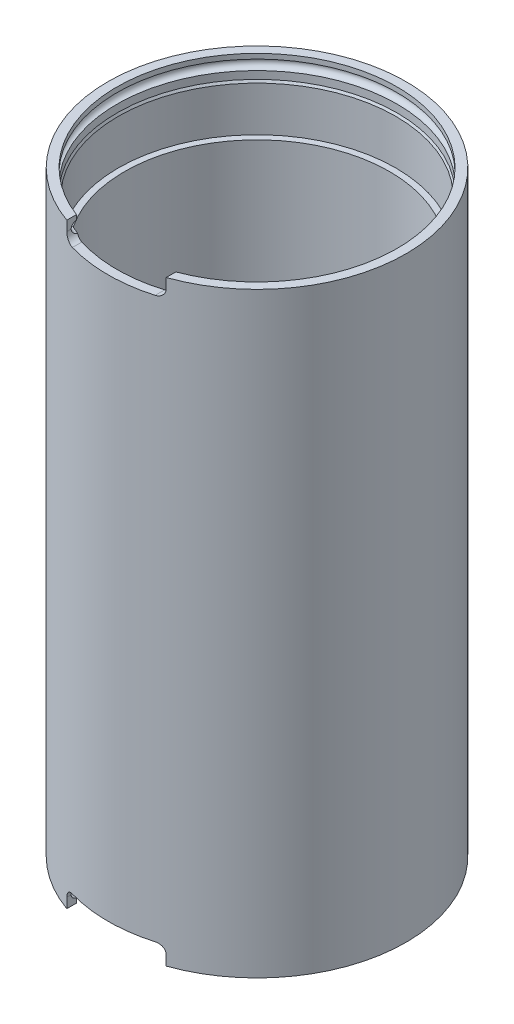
SolidWorks part; units mm, degrees
ref_plane "Front Plane" through (0, 0, 0) normal (0, 0, 1) x (1, 0, 0)
ref_plane "Top Plane" through (0, 0, 0) normal (0, 1, 0) x (1, 0, 0)
ref_plane "Right Plane" through (0, 0, 0) normal (1, 0, 0) x (0, 0, -1)
sketch "Sketch1" plane through (0, 0, 0) normal (0, 1, 0) x (1, 0, 0)
  circle A0 centre (0, 0) radius 57.15
  circle A1 centre (0, 0) radius 50.8
  dimension "D1" = 114.3
  dimension "D2" = 101.6
extrude "Boss-Extrude1" add sketch "Sketch1" along normal mid plane 228.6
sketch "Sketch3" plane through (0, 0, 0) normal (0, 0, 1) x (1, 0, 0)
  line L0 (0, -114.3) -> (0, 146.2879) construction
  line L1 (-50.8, -114.3) -> (50.8, -114.3) construction
  line L2 (-50.8, 114.3) -> (-53.6829, 114.3)
  line L3 (57.15, 114.3) -> (-57.15, 114.3) construction
  line L5 (-53.6829, 114.3) -> (-53.6829, 112.395)
  line L6 (-53.6829, 105.6549) -> (-53.1749, 104.775)
  line L7 (-53.1749, 104.775) -> (-53.1749, 87.63)
  line L8 (-53.1749, 87.63) -> (-50.8, 87.63)
  line L9 (-50.8, 87.63) -> (-50.8, 114.3)
  line L10 (-53.6829, 108.585) -> (-53.6829, 105.6549)
  arc A0 (-53.6829, 112.395) -> (-53.6829, 108.585) centre (-53.6829, 110.49) ccw
other "AlignGroup1" parameters "D4"=7.4171, "D1"=85.1374, "D2"=90, "D3"=101.6, "D5"=9.525, "D6"=26.67, "D7"=146.2879, "D8"=111.3446, "D9"=11.114
revolve "Cut-Revolve1" cut sketch "Sketch3" angle 360 about L0
sketch "Sketch4" plane through (0, 0, 0) normal (0, 0, 1) x (1, 0, 0)
  line L0 (53.6829, 114.3) -> (-53.6829, 114.3) construction
  line L1 (-19.05, 114.3) -> (19.05, 114.3)
  line L2 (-19.05, 114.3) -> (-19.05, 110.49)
  line L3 (-15.875, 107.315) -> (15.875, 107.315)
  line L4 (19.05, 114.3) -> (19.05, 110.49)
  line L10 (0, 0) -> (0, 107.315) construction
  arc A2 (15.875, 107.315) -> (19.05, 110.49) centre (15.875, 110.49) ccw
  arc A3 (-19.05, 110.49) -> (-15.875, 107.315) centre (-15.875, 110.49) ccw
  dimension "D1" = 3.175
  dimension "D2" = 6.985
  dimension "D3" = 38.1
extrude "Cut-Extrude1" cut sketch "Sketch4" along normal through all
mirror "Mirror1" about plane through (0, 0, 0) normal (0, 1, 0) of "Cut-Extrude1", "Cut-Revolve1"
